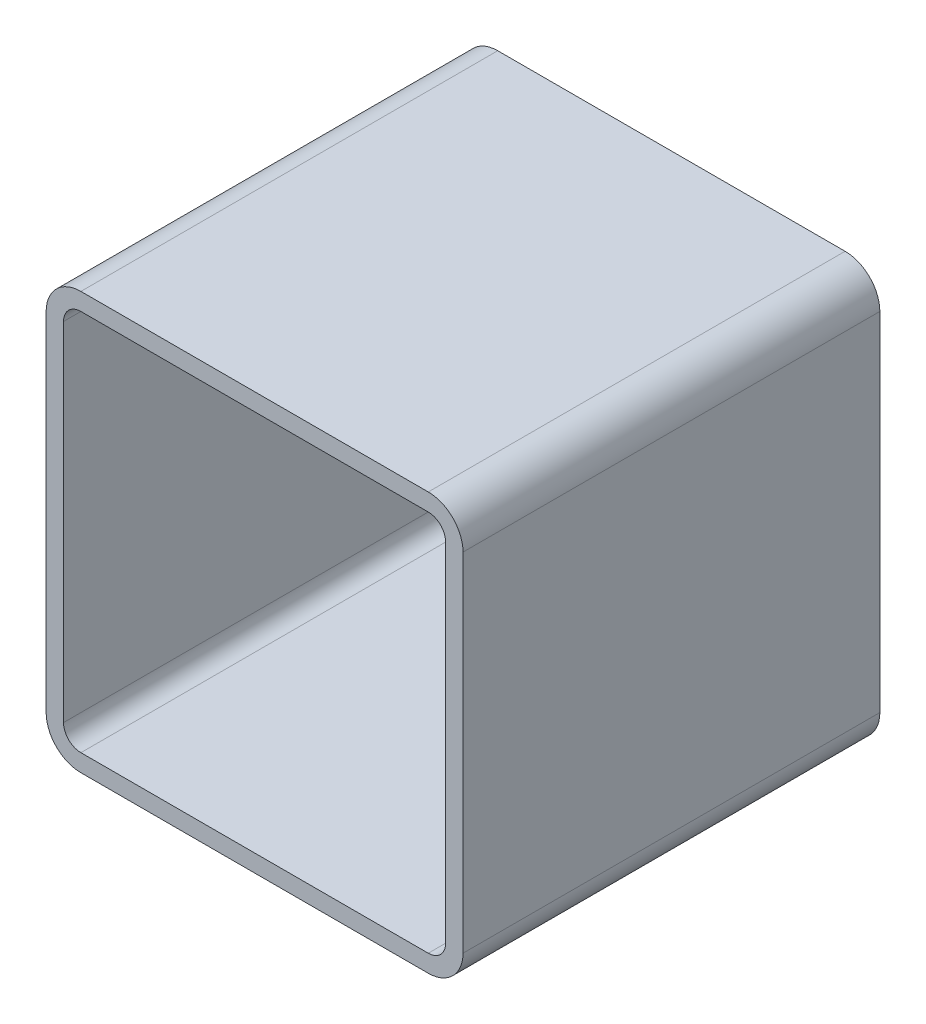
SolidWorks part; units mm, degrees
ref_plane "Front Plane" through (0, 0, 0) normal (0, 0, 1) x (1, 0, 0)
ref_plane "Top Plane" through (0, 0, 0) normal (0, 1, 0) x (1, 0, 0)
ref_plane "Right Plane" through (0, 0, 0) normal (1, 0, 0) x (0, 0, -1)
sketch "Sketch1" plane through (0, 0, 0) normal (0, 0, 1) x (1, 0, 0)
sketch_block_instance "HSS12x12x0.500-1"
sketch_block "HSS12x12x0.500"
extrude "Boss-Extrude1" add sketch "Sketch1" along normal blind 304.8
